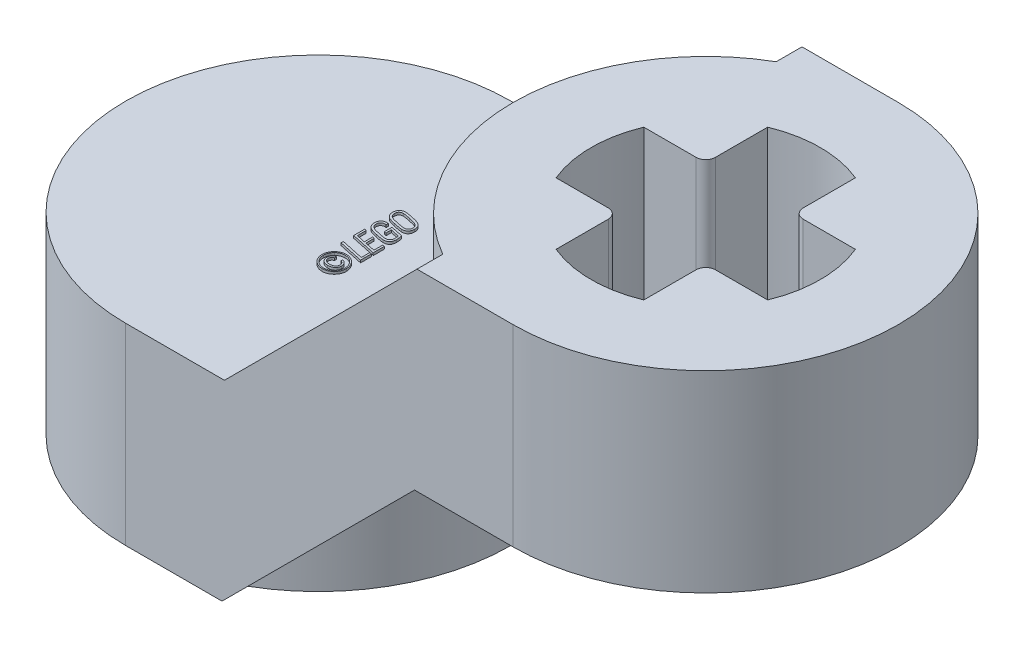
SolidWorks part; units mm, degrees
ref_plane "Plano1" through (0, 0, 0) normal (0, 0, 1) x (1, 0, 0)
ref_plane "Plano2" through (0, 0, 0) normal (0, 1, 0) x (1, 0, 0)
ref_plane "Plano3" through (0, 0, 0) normal (1, 0, 0) x (0, 0, -1)
sketch "Sketch1" plane through (0, 0, 0) normal (0, 0, 1) x (1, 0, 0)
  line L0 (7.95, 3.95) -> (7.95, 7.9)
  line L1 (0, 0) -> (1.975, 0)
  line L2 (4.5929, 0) -> (20.3979, 0) construction
  line L3 (0, 0) -> (0, 3.95)
  line L4 (0, 3.95) -> (2.025, 3.95)
  line L5 (7.95, 7.9) -> (5.975, 7.9)
  line L6 (1.975, 0) -> (5.925, 3.95)
  line L7 (5.975, 7.9) -> (2.025, 3.95)
  line L8 (5.925, 3.95) -> (7.95, 3.95)
  dimension "D1" = 3.95
  dimension "D2" = 1.975
  dimension "D3" = 3.95
  dimension "D4" = 7.95
  dimension "D5" = 45
  dimension "D6" = 45
extrude "Base-Extrude" add sketch "Sketch1" along normal mid plane 7.9
sketch "Sketch2" plane through (0, 7.9, 0) normal (0, 1, 0) x (-1, 0, 0)
  line L1 (-7.95, 3.95) -> (-7.95, -3.95) construction
  line L2 (-7.95, 3.95) -> (-7.95, -3.95)
  arc A0 (-7.95, 3.95) -> (-7.95, -3.95) centre (-7.95, 0) ccw
extrude "Boss-Extrude1" add sketch "Sketch2" against normal blind 3.95
sketch "Sketch3" plane through (0, 3.95, 0) normal (0, 1, 0) x (-1, 0, 0)
  line L0 (0, 3.95) -> (0, -3.95) construction
  line L1 (0, 3.95) -> (0, -3.95)
  arc A0 (0, -3.95) -> (0, 3.95) centre (0, 0) ccw
extrude "Boss-Extrude2" add sketch "Sketch3" against normal blind 3.95
sketch "Sketch6" plane through (0, 0, 0) normal (0, -1, 0) x (1, 0, 0)
  circle A0 centre (0, 0) radius 3.95
extrude "Boss-Extrude4" add sketch "Sketch6" against normal up to next
sketch "Sketch8" plane through (3.4574, 3.95, -0.4207) normal (0, 1, 0) x (0, 0, -1)
  text T0 "©LEGO" font "Zurich LtCn BT" height in points 2
extrude "Boss-Extrude5" add sketch "Sketch8" along normal blind 0.05
sketch "Sketch9" plane through (0, 7.9, 0) normal (0, 1, 0) x (1, 0, 0)
  line L0 (5.975, 3.4208) -> (5.975, -3.4208)
  line L1 (5.975, -3.95) -> (5.975, 3.95) construction
  arc A0 (5.975, 3.4208) -> (5.975, -3.4208) centre (7.95, 0) ccw
extrude "Boss-Extrude6" add sketch "Sketch9" against normal up to surface
sketch "Sketch10" plane through (0, 7.9, 0) normal (0, 1, 0) x (-1, 0, 0)
  line L0 (-4.3673, 0) -> (-13.8165, 0) construction
  line L1 (-7.95, -5.4069) -> (-7.95, 5.3727) construction
  line L2 (-5.7792, -0.9) -> (-7.05, -0.9)
  line L3 (-5.7792, 0.9) -> (-7.05, 0.9)
  line L4 (-8.85, -2.1708) -> (-8.85, -0.9)
  line L5 (-7.05, -2.1708) -> (-7.05, -0.9)
  line L6 (-8.85, -0.9) -> (-10.1208, -0.9)
  line L7 (-7.05, 0.9) -> (-7.05, 2.1708)
  line L8 (-8.85, 0.9) -> (-8.85, 2.1708)
  line L9 (-8.85, 0.9) -> (-10.1208, 0.9)
  arc A0 (-5.7792, -0.9) -> (-5.7792, 0.9) centre (-7.95, 0) ccw
  arc A1 (-8.85, -2.1708) -> (-7.05, -2.1708) centre (-7.95, 0) ccw
  arc A2 (-7.05, 2.1708) -> (-8.85, 2.1708) centre (-7.95, 0) ccw
  arc A3 (-10.1208, 0.9) -> (-10.1208, -0.9) centre (-7.95, 0) ccw
  dimension "D1" = 4.7
  dimension "D2" = 0.9
  dimension "D3" = 1.8
  dimension "D4" = 0.9
  dimension "D5" = 1.8
extrude "Cut-Extrude1" cut sketch "Sketch10" against normal blind 3.85
sketch "Sketch11" plane through (0, 0, 0) normal (0, -1, 0) x (1, 0, 0)
  line L0 (-6.8667, 0) -> (6.3778, 0) construction
  line L1 (0, -5.4507) -> (0, 8.5435) construction
  line L2 (-2.1708, -0.9) -> (-0.9, -0.9)
  line L3 (-2.1708, 0.9) -> (-0.9, 0.9)
  line L4 (-0.9, 2.1708) -> (-0.9, 0.9)
  line L5 (0.9, 2.1708) -> (0.9, 0.9)
  line L6 (0.9, 0.9) -> (2.1708, 0.9)
  line L7 (0.9, -0.9) -> (2.1708, -0.9)
  line L8 (-0.9, -0.9) -> (-0.9, -2.1708)
  line L9 (0.9, -0.9) -> (0.9, -2.1708)
  arc A0 (0.9, 2.1708) -> (-0.9, 2.1708) centre (0, 0) ccw
  arc A1 (-2.1708, 0.9) -> (-2.1708, -0.9) centre (0, 0) ccw
  arc A2 (2.1708, -0.9) -> (2.1708, 0.9) centre (0, 0) ccw
  arc A3 (-0.9, -2.1708) -> (0.9, -2.1708) centre (0, 0) ccw
  dimension "D1" = 4.7
  dimension "D2" = 0.9
  dimension "D3" = 1.8
  dimension "D4" = 0.9
  dimension "D5" = 1.8
extrude "Cut-Extrude2" cut sketch "Sketch11" against normal blind 3.85
fillet "Fillet1" radius 0.2 8 edges at (7.05, 5.975, 0.9) (8.85, 5.975, 0.9) (8.85, 5.975, -0.9) (7.05, 5.975, -0.9) (-0.9, 1.925, -0.9) (-0.9, 1.925, 0.9) (0.9, 1.925, 0.9) (0.9, 1.925, -0.9)
